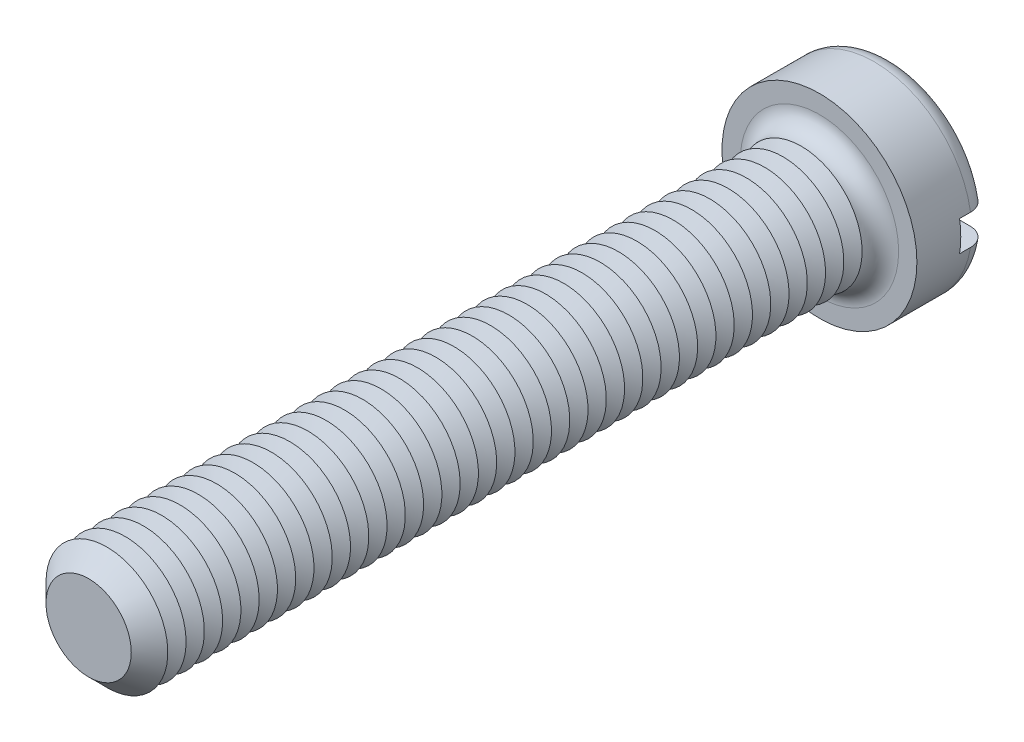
SolidWorks part; units mm, degrees
ref_plane "Front Plane" through (0, 0, 0) normal (0, 0, 1) x (1, 0, 0)
ref_plane "Top Plane" through (0, 0, 0) normal (0, 1, 0) x (1, 0, 0)
ref_plane "Right Plane" through (0, 0, 0) normal (1, 0, 0) x (0, 0, -1)
sketch "Sketch3" plane through (0, 0, 0) normal (0, 0, 1) x (1, 0, 0)
  circle A0 centre (0, 0) radius 8
  dimension "D1" = 16
extrude "Boss-Extrude2" add sketch "Sketch3" against normal blind 6
sketch "Sketch4" plane through (0, 0, 0) normal (0, 0, 1) x (1, 0, 0)
  circle A0 centre (0, 0) radius 5
  dimension "D1" = 10
extrude "Boss-Extrude3" add sketch "Sketch4" along normal blind 60
fillet "Fillet1" radius 1.5 2 edges at (8, 0, -6) (5, 0, 0)
chamfer "Chamfer1" distance 1.5 angle 45 1 edges at (5, 0, 60)
sketch "Sketch5" plane through (0, 0, 0) normal (1, 0, 0) x (0, 0, -1)
  line L0 (1.6944, 0) -> (-7.6738, 0) construction
sketch "Sketch6" plane through (0, 0, 0) normal (1, 0, 0) x (0, 0, -1)
  line L0 (-1.5, 5) -> (-2.25, 3.701)
  line L1 (-2.25, 3.701) -> (-3, 5)
  line L2 (-1.5, 5) -> (-58.5, 5) construction
  line L3 (-3, 5) -> (-1.5, 5)
  dimension "D1" = 1.5
revolve "Cut-Revolve1" cut sketch "Sketch6" angle 360 about L0
pattern_linear "LPattern1" count 38 spacing 1.5 along (0, 0, 1) of "Cut-Revolve1"
sketch "Sketch8" plane through (0, 0, -6) normal (0, 0, -1) x (-1, 0, 0)
  line L1 (8, -1.25) -> (-8, -1.25)
  line L2 (8, -1.25) -> (8, 1.25)
  line L3 (8, 1.25) -> (-8, 1.25)
  line L4 (-8, -1.25) -> (-8, 1.25)
  line L5 (8, -1.25) -> (-8, 1.25) construction
  line L6 (8, 1.25) -> (-8, -1.25) construction
  point P0 (0, 0)
  dimension "D1" = 16
  dimension "D2" = 2.5
extrude "Cut-Extrude1" cut sketch "Sketch8" against normal blind 2.4
